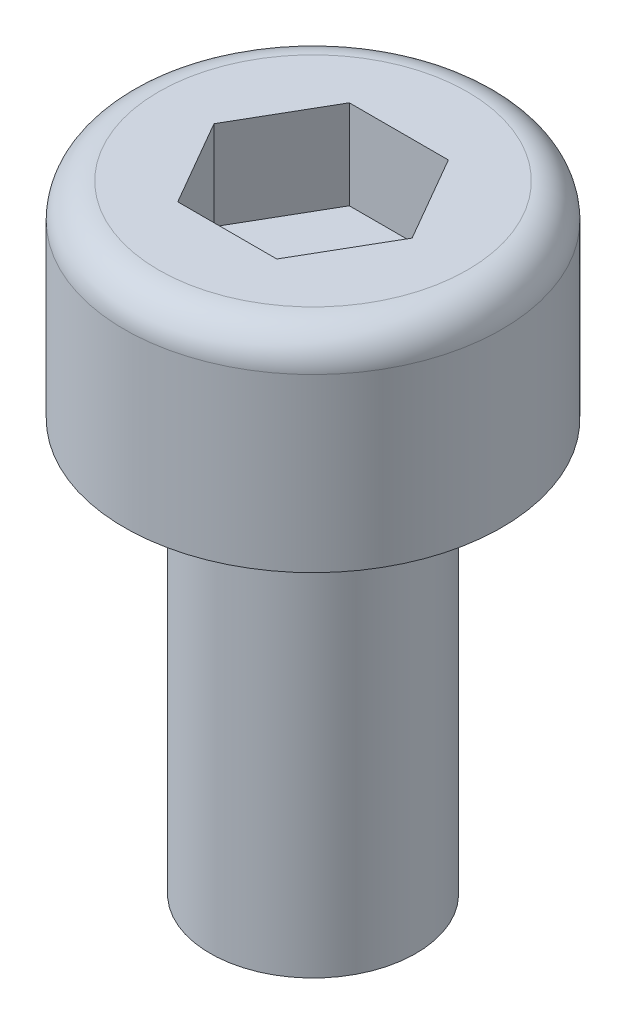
SolidWorks part; units mm, degrees
ref_plane "Aufriss" through (0, 0, 0) normal (0, 0, 1) x (1, 0, 0)
ref_plane "Grundriss" through (0, 0, 0) normal (0, 1, 0) x (1, 0, 0)
ref_plane "Seitenriss" through (0, 0, 0) normal (1, 0, 0) x (0, 0, -1)
sketch "Skizze1" plane through (0, 0, 0) normal (0, 0, 1) x (1, 0, 0)
  line L0 (0, 0) -> (-1.5, 0)
  line L1 (-1.5, 0) -> (-1.5, 6)
  line L2 (-1.5, 6) -> (-2.75, 6)
  line L3 (-2.75, 6) -> (-2.75, 8.5)
  line L4 (-2.25, 9) -> (0, 9)
  line L5 (0, 0) -> (0, 9) construction
  line L6 (0, 0) -> (0, 9)
  arc A0 (-2.75, 8.5) -> (-2.25, 9) centre (-2.25, 8.5) cw
  dimension "D1" = 3
  dimension "D5" = 0.5
  dimension "D2" = 5.5
  dimension "D3" = 6
  dimension "D4" = 3
revolve "Rotation1" add sketch "Skizze1" angle 360 about L5
sketch "Skizze2" plane through (0, 9, 0) normal (0, 1, 0) x (1, 0, 0)
  line L1 (0.7217, 1.25) -> (-0.7217, 1.25)
  line L2 (-0.7217, 1.25) -> (-1.4434, 0)
  line L3 (-1.4434, 0) -> (-0.7217, -1.25)
  line L4 (-0.7217, -1.25) -> (0.7217, -1.25)
  line L5 (0.7217, -1.25) -> (1.4434, 0)
  line L6 (1.4434, 0) -> (0.7217, 1.25)
  circle A0 centre (0, 0) radius 1.25 construction
  dimension "D1" = 2.5
extrude "Schnitt-Linear austragen1" cut sketch "Skizze2" against normal blind 1.3
